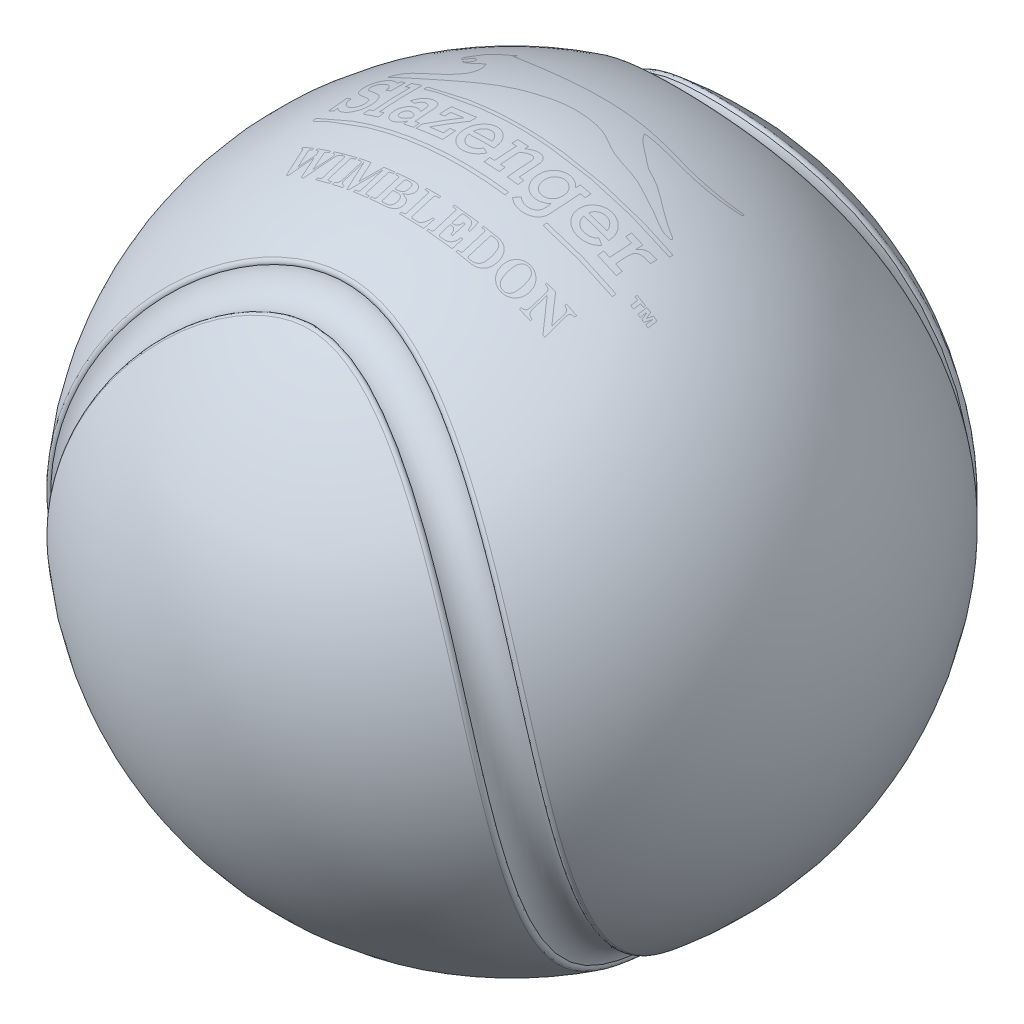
SolidWorks part; units mm, degrees
ref_plane "Front Plane" through (0, 0, 0) normal (0, 0, 1) x (1, 0, 0)
ref_plane "Top Plane" through (0, 0, 0) normal (0, 1, 0) x (1, 0, 0)
ref_plane "Right Plane" through (0, 0, 0) normal (1, 0, 0) x (0, 0, -1)
sketch "Sketch1" plane through (0, 0, 0) normal (1, 0, 0) x (0, 0, -1)
  line L0 (0, 36) -> (0, -36)
  arc A0 (0, 36) -> (0, -36) centre (0, 0) ccw
  dimension "D1" = 72
revolve "Revolve1" add sketch "Sketch1" angle 360 about L0
sketch "Sketch2" plane through (0, 0, 0) normal (1, 0, 0) x (0, 0, -1)
  line L0 (-20, 29.9333) -> (20, 29.9333) construction
  circle A0 centre (0, 0) radius 36 construction
  dimension "D1" = 40
sketch "Sketch3" plane through (0, 0, 0) normal (0, 0, 1) x (1, 0, 0)
  line L0 (-20, -29.9333) -> (20, -29.9333) construction
  circle A0 centre (0, 0) radius 36 construction
  dimension "D1" = 40
sketch "Sketch4" plane through (0, 0, 0) normal (0, 1, 0) x (1, 0, 0)
  line L1 (-25.4558, -25.4558) -> (25.4558, -25.4558)
  line L2 (-25.4558, -25.4558) -> (-25.4558, 25.4558)
  line L3 (-25.4558, 25.4558) -> (25.4558, 25.4558)
  line L4 (25.4558, -25.4558) -> (25.4558, 25.4558)
  line L5 (-25.4558, -25.4558) -> (25.4558, 25.4558) construction
  line L6 (-25.4558, 25.4558) -> (25.4558, -25.4558) construction
  circle A0 centre (0, 0) radius 36 construction
  point P0 (0, 0)
  dimension "D1" = 90
sketch3d "3DSketch1"
  spline S0 degree 3 poles (-35.0672, 0, 35.0672) (0, 44.8999, 12.4664) (35.0672, 0, 35.0672) (12.4664, -44.8999, 0) (35.0672, 0, -35.0672) (0, 44.8999, -12.4664) (-35.0672, 0, -35.0672) (-12.4664, -44.8999, 0) (-35.0672, 0, 35.0672) (0, 44.8999, 12.4664) (35.0672, 0, 35.0672) knots -0.375 -0.25 -0.125 0 0.125 0.25 0.375 0.5 0.625 0.75 0.875 1 1.125 1.25 1.375 only from (0, 29.9333, 20) to (0, 29.9333, 20)
sketch "Sketch10" plane through (0, 0, 0) normal (1, 0, 0) x (0, 0, -1)
  line L0 (-23.426, 30.8669) -> (-21.5343, 28.3743)
  line L1 (-19.695, 33.3714) -> (-18.1252, 30.7116)
  arc A0 (-21.5343, 28.3743) -> (-18.1252, 30.7116) centre (-21.1553, 31.4764) ccw
  arc A2 (-19.695, 33.3714) -> (-23.426, 30.8669) centre (0, 0) ccw
sweep "Cut-Sweep1" cut profiles "Sketch10" path "3DSketch1" parameters "D1"=0
fillet "Fillet1" radius 0.5 2 edges at (1.6476, 28.578, 21.8308) (-1.8919, 30.9061, 18.3639)
sketch "Sketch15" plane through (0, 0, 0) normal (0, 1, 0) x (1, 0, 0)
  line L0 (-30.6698, -4.1611) -> (30.9105, -4.1611)
  line L1 (16.5667, -4.8845) -> (20.7533, -4.8845)
  line L2 (-21.6435, -11.9161) -> (23.9538, -11.9161)
sketch "Sketch13" plane through (0, 0, 0) normal (0, 1, 0) x (1, 0, 0)
  line L0 (-9.7447, 10.3683) -> (-10.0058, 10.0187)
  line L2 (-10.3266, 1.0871) -> (16.4955, 1.0871)
  line L3 (-10.3266, 1.0871) -> (-10.3266, 0.6871)
  line L4 (-10.3266, 0.6871) -> (16.4955, 0.6871)
  line L5 (16.4955, 1.0871) -> (16.4955, 0.6871)
  line L6 (16.5828, -5.2255) -> (9.0251, -5.2255)
  line L7 (16.5828, -5.2255) -> (16.5828, -5.6255)
  line L8 (16.5828, -5.6255) -> (9.0251, -5.6255)
  line L9 (9.0251, -5.2255) -> (9.0251, -5.6255)
  line L10 (4.874, -5.2255) -> (-16.1703, -5.2255)
  line L11 (4.874, -5.2255) -> (4.874, -5.6255)
  line L12 (4.874, -5.6255) -> (-16.1703, -5.6255)
  line L13 (-16.1703, -5.2255) -> (-16.1703, -5.6255)
  arc A0 (15.511, 9.8152) -> (15.511, 9.5119) centre (15.4147, 9.6636) cw
  arc A1 (15.3193, 2.1995) -> (15.3193, 1.8869) centre (15.2597, 2.0432) cw
  spline S0 degree 3 poles (-10.0058, 10.0187) (-6.0767, 8.9289) (-0.5, 9.4233) (6.8166, 9.2912) (11.3785, 8.4535) (14.4047, 9.2069) (15.511, 9.8152) knots 0 0 0 0 0.466653 0.646913 0.853131 1 1 1 1
  spline S1 degree 3 poles (15.511, 9.5119) (13.8488, 8.4854) (10.4979, 8.0388) (7.2833, 8.6427) (5.9249, 8.516) knots 0 0 0 0 0.586027 1 1 1 1
  spline S2 degree 3 poles (5.9249, 8.516) (6.5827, 7.4675) (7.9628, 6.6952) (9.338, 5.4932) (10.8993, 5.0139) (12.7133, 3.6373) (14.4124, 2.5922) (15.3193, 2.1995) knots 0 0 0 0 0.317155 0.410204 0.473333 0.741522 1 1 1 1
  spline S3 degree 3 poles (15.3193, 1.8869) (14.4829, 1.7211) (13.3706, 2.4758) (11.6131, 3.0029) (9.5895, 4.0461) (6.9109, 4.0177) (4.5253, 5.7413) (2.1858, 6.0347) (-0.3906, 5.9803) (-2.6238, 5.352) (-5.8887, 4.3918) (-9.7471, 2.4534) (-13.4347, 1.8329) (-15.3492, 1.8119) knots 0 0 0 0 0.074832 0.119128 0.172508 0.286131 0.356824 0.440116 0.501193 0.598176 0.655595 0.820342 1 1 1 1
  spline S4 degree 3 poles (-15.3492, 1.8119) (-15.0145, 2.6744) (-13.4533, 3.0139) (-11.2827, 3.3178) (-8.8523, 4.5503) (-9.3834, 6.4852) (-9.8428, 6.9798) knots 0 0 0 0 0.27142 0.475416 0.765028 1 1 1 1
  spline S5 degree 3 poles (-9.8428, 6.9798) (-10.1867, 6.9431) (-10.8452, 6.5443) (-11.6137, 6.3131) (-12.0358, 6.5753) knots 0 0 0 0 0.439463 1 1 1 1
  spline S6 degree 3 poles (-12.0358, 6.5753) (-11.7911, 6.5595) (-11.3796, 6.6838) (-11.1757, 7.1833) (-11.335, 7.5492) (-11.7063, 7.7238) (-12.1094, 7.4098) (-12.4564, 7.2684) (-12.3814, 6.9088) knots 0 0 0 0 0.259119 0.375103 0.50972 0.631883 0.729715 1 1 1 1
  spline S7 degree 3 poles (-12.3814, 6.9088) (-13.0819, 7.34) (-12.5132, 7.8951) (-12.2325, 8.6994) (-11.5192, 9.7394) (-10.3645, 9.9106) (-9.7447, 10.3683) knots 0 0 0 0 0.263043 0.412765 0.513713 1 1 1 1
  text T0 "Slazenger" font "Rockwell" height 5.3
  text T1 "TM" font "Arial Black" height 1
  text T2 "WIMBLEDON" font "Century Schoolbook" height 3
  dimension "D1" = 0.4
  dimension "D2" = 0.4
  dimension "D3" = 0.4
